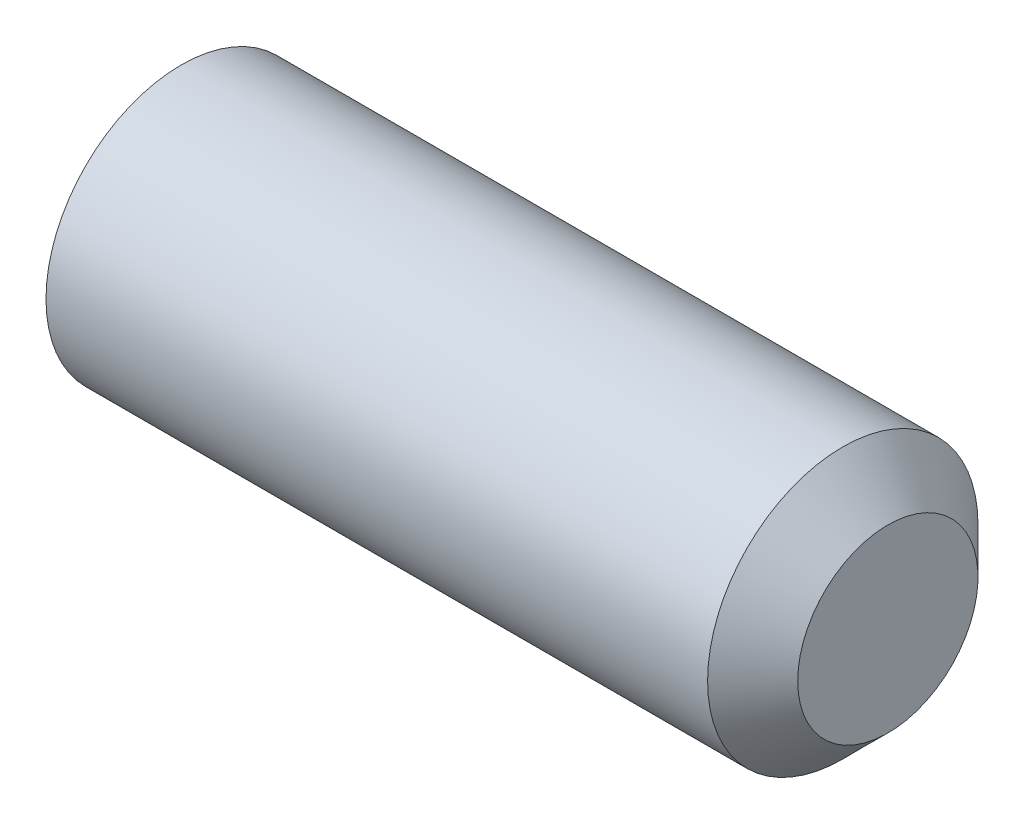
SolidWorks part; units mm, degrees
ref_plane "Plane1" through (0, 0, 0) normal (0, 0, 1) x (1, 0, 0)
ref_plane "Plane2" through (0, 0, 0) normal (0, 1, 0) x (1, 0, 0)
ref_plane "Plane3" through (0, 0, 0) normal (1, 0, 0) x (0, 0, -1)
sketch "BodySke" plane through (0, 0, 0) normal (0, 0, 1) x (1, 0, 0)
  line L0 (0, 0) -> (0, 2.4455)
  line L1 (0, 2.4455) -> (0.3201, 3)
  line L2 (0.3201, 3) -> (15, 3)
  line L3 (15, 3) -> (16, 2)
  line L4 (16, 0) -> (0, 0)
  line L5 (-12.7, 0) -> (88.9, 0) construction
  line L6 (16, 2) -> (16, 0)
  line L7 (16, 2) -> (16, 11.525) construction
  line L8 (0, -2.4455) -> (0.3201, -3) construction
  line L9 (1, 15.875) -> (1, -3.175) construction
  line L10 (15, -3) -> (16, -2) construction
  dimension "Length" = 16
  dimension "Diameter" = 6
  dimension "Drive_ch_ang" = 60
  dimension "Minor_dia" = 4.891
  dimension "Cup_nose_ang" = 45
  dimension "Cup_dia" = 4
  dimension "Advance" = 1
revolve "BaseBody" add sketch "BodySke" angle 360 about L5
sketch "Sketch2" plane through (0, 0, 0) normal (-1, 0, 0) x (0, 0, 1)
  line L0 (0.866, 1.5) -> (-0.866, 1.5)
  line L1 (-0.866, 1.5) -> (-1.7321, 0)
  line L2 (0.866, 1.5) -> (1.7321, 0)
  line L3 (0.866, -1.5) -> (1.7321, 0)
  line L4 (0.866, -1.5) -> (-0.866, -1.5)
  line L5 (-0.866, -1.5) -> (-1.7321, 0)
  dimension "Hex_size" = 3
  dimension "D2" = 1.5
  dimension "D3" = 1.5
extrude "Hex" cut sketch "Sketch2" against normal blind 3.5
sketch "ThdSchSke" plane through (0, 0, 0) normal (0, 0, 1) x (1, 0, 0)
  line L0 (0.3201, -2.4455) -> (-0.0681, -3)
  line L1 (0.3201, -2.4455) -> (0.7084, -3)
  line L2 (0.7084, -3) -> (0.7084, -3.75)
  line L3 (-3.175, 0) -> (5.1513, 0) construction
  line L5 (0.7084, -3.75) -> (-0.0681, -3.75)
  line L6 (-0.0681, -3.75) -> (-0.0681, -3)
  line L8 (0.3201, 3) -> (0.3201, -3) construction
  dimension "Thread_minor" = 4.891
  dimension "Diameter" = 6
  dimension "SideAngle" = 55
  dimension "VeeAngle" = 70
  dimension "Overcut" = 7.5
revolve "ThreadSchematic" [suppressed] cut sketch "ThdSchSke" angle 360 about L3
pattern_linear "ThdSchPat" [suppressed]
equation "\"D2@Sketch2\" = \"Hex_size@Sketch2\" / 2"
equation "\"D3@Sketch2\" = \"Hex_size@Sketch2\" / 2"
equation "\"Thread_minor@ThreadCosmetic\" = \"Minor_dia@BodySke\""
equation "\"Thread_minor@ThdSchSke\" = \"Thread_minor@ThreadCosmetic\""
equation "\"Diameter@ThdSchSke\" = \"Diameter@BodySke\""
equation "\"Overcut@ThdSchSke\" = \"Diameter@BodySke\" * 1.25"
equation "\"Num_threads@ThdSchPat\" = int( (\"Length@BodySke\" - ( ( ( \"Diameter@BodySke\" - \"Minor_dia@BodySke\" ) * 0.5 ) / tan( \"Drive_ch_ang@BodySke\" * 0.017453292 ) ) - ( ( ( \"Diameter@BodySke\" - \"Cup_dia@BodySk"
equation "\"Advance@ThdSchPat\" = (\"Length@BodySke\" - ( ( ( \"Diameter@BodySke\" - \"Minor_dia@BodySke\" ) * 0.5 ) / tan( \"Drive_ch_ang@BodySke\" * 0.017453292 ) ) - ( ( ( \"Diameter@BodySke\" - \"Cup_dia@BodySke\" ) * 0."
equation "' \"Num_threads@ThdSchPat\" = \"Num_threads@ThdSchPat\" - sgn( \"Num_threads@ThdSchPat\" - 1) '---chamfered tips only---"
